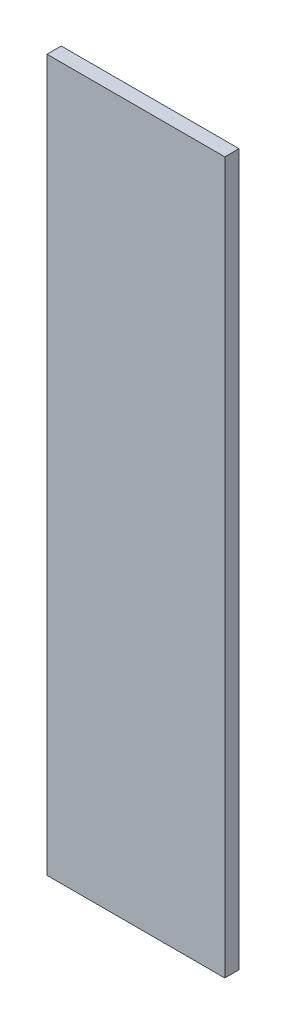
SolidWorks part; units mm, degrees
ref_plane "Front Plane" through (0, 0, 0) normal (0, 0, 1) x (1, 0, 0)
ref_plane "Top Plane" through (0, 0, 0) normal (0, 1, 0) x (1, 0, 0)
ref_plane "Right Plane" through (0, 0, 0) normal (1, 0, 0) x (0, 0, -1)
sketch "Sketch1" plane through (0, 0, 0) normal (0, 0, 1) x (1, 0, 0)
  line L1 (-179.5334, 18.5167) -> (-204.5334, 18.5167)
  line L2 (-179.5334, 18.5167) -> (-179.5334, -81.4833)
  line L3 (-179.5334, -81.4833) -> (-204.5334, -81.4833)
  line L4 (-204.5334, 18.5167) -> (-204.5334, -81.4833)
  dimension "D1" = 25
  dimension "D2" = 100
extrude "Extrude1" add sketch "Sketch1" along normal blind 2
